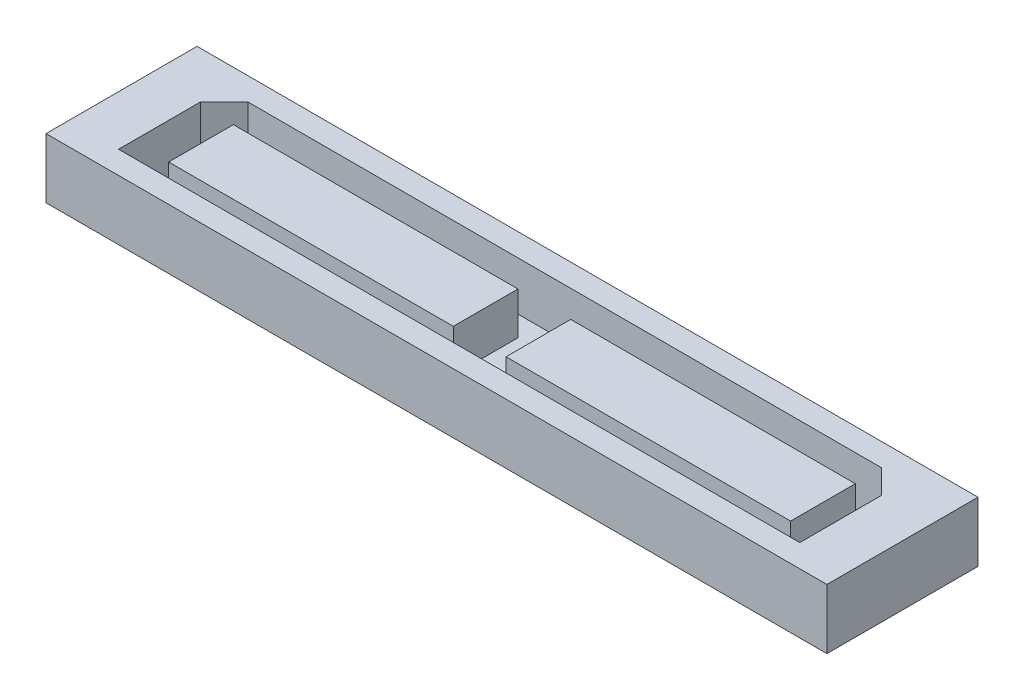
SolidWorks part; units mm, degrees
ref_plane "Plane1" through (0, 0, 0) normal (0, 0, 1) x (1, 0, 0)
ref_plane "Plane2" through (0, 0, 0) normal (0, 1, 0) x (1, 0, 0)
ref_plane "Plane3" through (0, 0, 0) normal (1, 0, 0) x (0, 0, -1)
ref_plane "Plane4" through (0, 3.6322, 0) normal (0, 1, 0) x (-1, 0, 0)
sketch "Sketch1" plane through (0, 3.6322, 0) normal (0, 1, 0) x (-1, 0, 0)
  line L0 (-23, -4.45) -> (23, -4.45)
  line L1 (23, -4.45) -> (23, 4.45)
  line L2 (23, 4.45) -> (-23, 4.45)
  line L3 (-23, 4.45) -> (-23, -4.45)
  line L4 (23, -4.45) -> (-23, 4.45) construction
  dimension "D1" = 46
  dimension "D2" = 8.9
extrude "Extrude1" add sketch "Sketch1" against normal blind 3.5306
sketch "Sketch2" plane through (0, 0, 4.45) normal (0, 0, 1) x (1, 0, 0)
  line L0 (17.6974, 0.381) -> (17.6974, 0)
  line L1 (17.6974, 0) -> (2.3051, 0)
  line L2 (2.3051, 0) -> (2.3051, 0.381)
  line L3 (2.3051, 0.381) -> (17.6974, 0.381)
  line L4 (0, 0) -> (0, 6.1865) construction
  line L5 (-2.3051, 0.381) -> (-17.6974, 0.381)
  line L6 (-2.3051, 0) -> (-2.3051, 0.381)
  line L7 (-17.6974, 0) -> (-2.3051, 0)
  line L8 (-17.6974, 0.381) -> (-17.6974, 0)
  dimension "D1" = 0.381
  dimension "D2" = 2.3051
  dimension "D3" = 15.3924
extrude "Extrude2" [suppressed] add sketch "Sketch2" along normal blind 0.127
mirror "Mirror1" [suppressed] about plane through (0, 0, 0) normal (0, 0, 1)
sketch "Sketch7" plane through (0, 3.6322, 0) normal (0, 1, 0) x (-1, 0, 0)
  line L0 (20.0654, 3.1115) -> (-20.0654, 3.1115)
  line L1 (-20.0654, 3.1115) -> (-20.0654, -3.1115)
  line L2 (-20.0654, -3.1115) -> (20.0654, -3.1115)
  line L3 (20.0654, -3.1115) -> (20.0654, 3.1115)
  line L4 (-20.0654, 3.1115) -> (20.0654, -3.1115) construction
  dimension "D1" = 40.1307
  dimension "D2" = 6.223
extrude "Cut-Extrude1" cut sketch "Sketch7" against normal blind 2.8702
sketch "Sketch8" plane through (0, 0.762, 0) normal (0, 1, 0) x (-1, 0, 0)
  line L0 (-1.5532, -1.905) -> (-18.3172, -1.905)
  line L1 (-18.3172, -1.905) -> (-18.3172, 1.905)
  line L2 (-18.3172, 1.905) -> (-1.5532, 1.905)
  line L3 (-1.5532, 1.905) -> (-1.5532, -1.905)
  line L4 (0, 0) -> (-1.5532, 0) construction
  line L5 (0, 0) -> (0, 7.6985) construction
  line L6 (1.5532, 1.905) -> (1.5532, -1.905)
  line L7 (18.3172, 1.905) -> (1.5532, 1.905)
  line L8 (18.3172, -1.905) -> (18.3172, 1.905)
  line L9 (1.5532, -1.905) -> (18.3172, -1.905)
  dimension "D1" = 16.764
  dimension "D2" = 3.81
  dimension "D3" = 1.5532
extrude "Extrude7" add sketch "Sketch8" along normal blind 2.4892
hole_wizard "Hole2" positions "Sketch15" profile "Sketch14" legacy
sketch "Sketch15" plane through (0, 0.1016, 0) normal (0, -1, 0) x (1, 0, 0)
  line L0 (0, 0) -> (0, 6.0416) construction
  point P0 (25, 0)
  point P6 (-25, 0)
  dimension "D1" = 25
sketch "Sketch14" plane through (25, 0.1016, 0) normal (1, 0, 0) x (0, 0, -1)
  line L0 (0, 0) -> (0, 3.5306)
  line L1 (0, 3.5306) -> (1.778, 3.5306)
  line L2 (1.778, 3.5306) -> (1.778, 0)
  line L3 (1.778, 0) -> (0, 0)
  line L4 (0, 110) -> (0, -10) construction
  dimension "Diameter" = 3.556
  dimension "Depth" = 3.5306
chamfer "Chamfer2" distance 1.397 angle 45 2 edges at (20.0654, 2.1971, -3.1115) (-20.0654, 2.1971, -3.1115)
sketch "Sketch10" plane through (0, 0.1016, 0) normal (0, -1, 0) x (1, 0, 0)
  line L0 (0, 0) -> (0, -7.043) construction
  circle A0 centre (19.9384, -2.667) radius 0.4445
  circle A1 centre (-19.9384, -2.667) radius 0.4445
  dimension "D1" = 0.889
  dimension "D2" = 39.8767
  dimension "D3" = 2.667
extrude "Extrude9" [suppressed] add sketch "Sketch10" along normal blind 1.27
